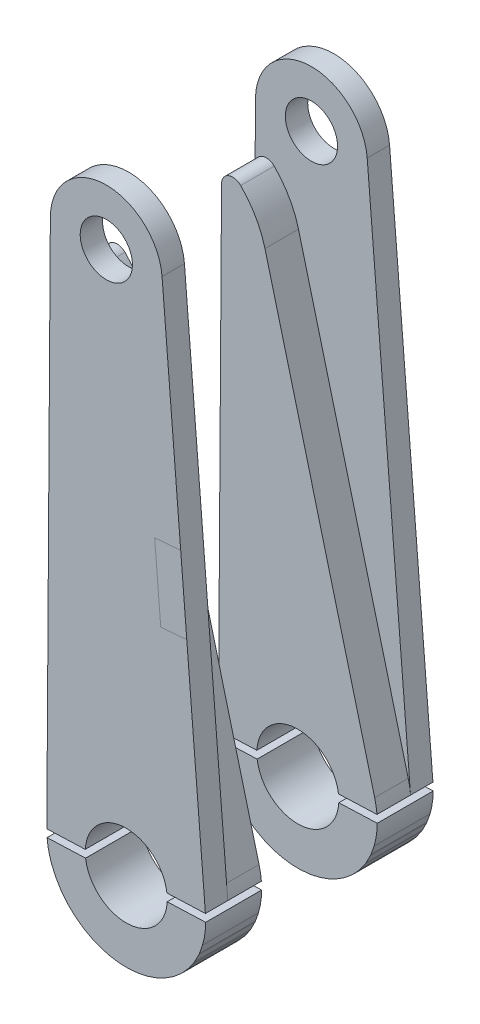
SolidWorks part; units mm, degrees
ref_plane "Ebene vorne" through (0, 0, 0) normal (0, 0, 1) x (1, 0, 0)
ref_plane "Ebene oben" through (0, 0, 0) normal (0, 1, 0) x (1, 0, 0)
ref_plane "Ebene rechts" through (0, 0, 0) normal (1, 0, 0) x (0, 0, -1)
imported_body "Defeature ausgeführt1"
imported_body "Defeature ausgeführt2"
imported_body "Defeature ausgeführt9"
imported_body "Defeature ausgeführt10"
other "Fläche löschen2"
sketch "Skizze1" plane through (0, 0, 24.5) normal (0, 0, -1) x (-1, 0, 0)
  line L0 (-211.4534, 415.1246) -> (-208.8648, 446.7781)
  line L1 (-211.4534, 415.1246) -> (-203.2162, 414.451)
  line L2 (-208.8648, 446.7781) -> (-200.6277, 446.1045)
  line L3 (-203.2162, 414.451) -> (-200.6277, 446.1045)
  line L4 (-216.0278, 359.188) -> (-204.4072, 501.2866) construction
extrude "Aufsatz-Linear austragen1" add sketch "Skizze1" against normal blind 1
sketch "Skizze2" plane through (0, 0, -24.5) normal (0, 0, 1) x (1, 0, 0)
  line L0 (211.5094, 414.4395) -> (208.7848, 447.7573)
  line L1 (211.5094, 414.4395) -> (203.9263, 413.8194)
  line L2 (208.7848, 447.7573) -> (201.2017, 447.1372)
  line L3 (203.9263, 413.8194) -> (201.2017, 447.1372)
  line L4 (216.0278, 359.188) -> (204.4072, 501.2866) construction
extrude "Aufsatz-Linear austragen2" add sketch "Skizze2" against normal blind 1
